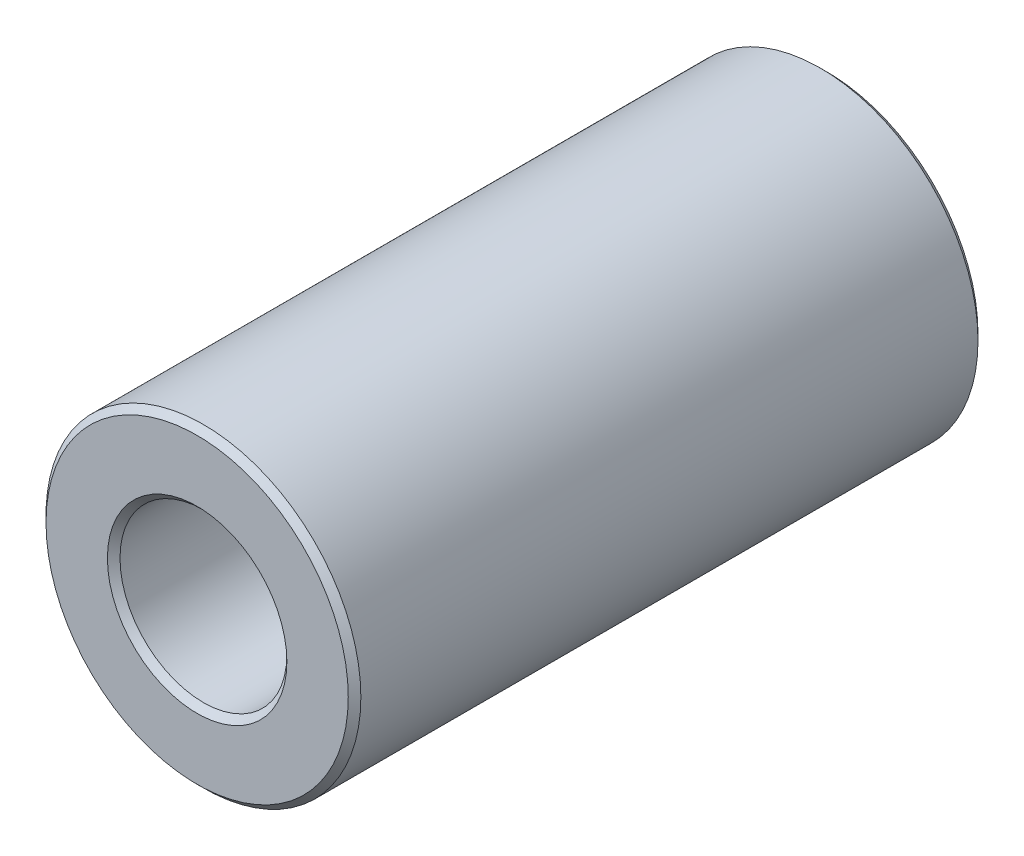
SolidWorks part; units mm, degrees
ref_plane "Front Plane" through (0, 0, 0) normal (0, 0, 1) x (1, 0, 0)
ref_plane "Top Plane" through (0, 0, 0) normal (0, 1, 0) x (1, 0, 0)
ref_plane "Right Plane" through (0, 0, 0) normal (1, 0, 0) x (0, 0, -1)
sketch "Sketch1" plane through (0, 0, 0) normal (0, 0, 1) x (1, 0, 0)
  circle A0 centre (0, 0) radius 5
  circle A1 centre (0, 0) radius 2.65
  dimension "D1" = 10
  dimension "D2" = 5.3
extrude "Boss-Extrude2" add sketch "Sketch1" along normal mid plane 20
chamfer "Chamfer3" distance 0.2 angle 45 4 edges at (5, 0, 10) (5, 0, -10) (2.65, 0, -10) (2.65, 0, 10)
